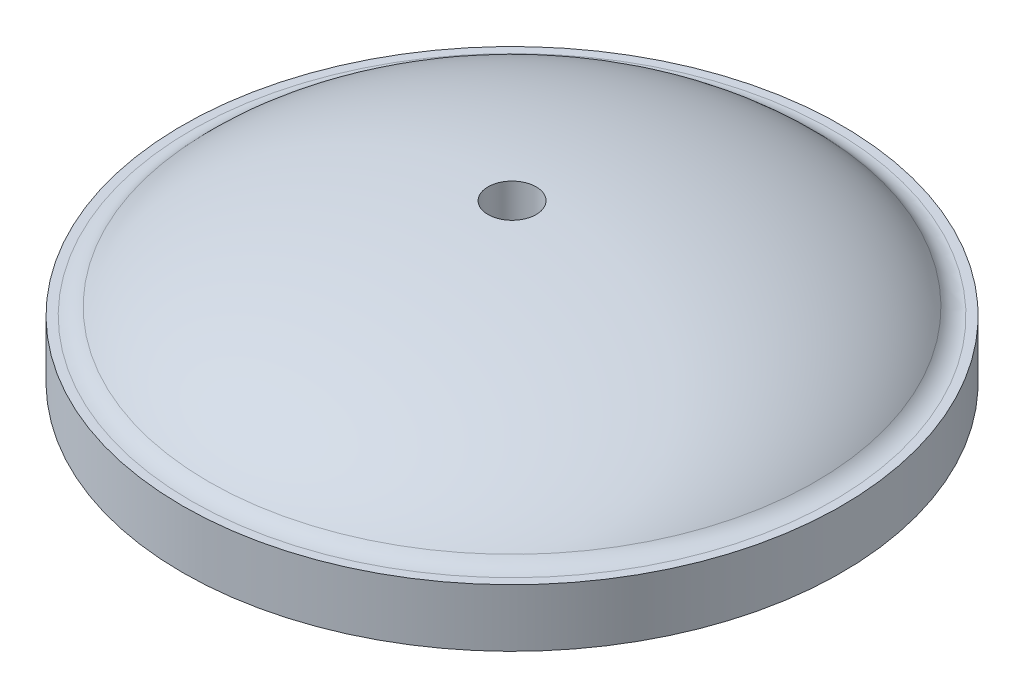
SolidWorks part; units mm, degrees
ref_plane "Plane1" through (0, 0, 0) normal (0, 0, 1) x (1, 0, 0)
ref_plane "Plane2" through (0, 0, 0) normal (0, 1, 0) x (1, 0, 0)
ref_plane "Plane3" through (0, 0, 0) normal (1, 0, 0) x (0, 0, -1)
sketch "Sketch2" plane through (0, 0, 0) normal (0, 0, 1) x (1, 0, 0)
  line L0 (-92.202, 0) -> (106.172, 0) construction
  line L1 (0, 86.36) -> (0, -75.946) construction
  line L2 (13.335, 22.4242) -> (13.335, 5.9944)
  line L3 (58.8, 22.4242) -> (13.335, 22.4242)
  line L4 (8.2296, 6.5024) -> (12.7, 6.5024) construction
  line L5 (71.5, 9.7242) -> (71.5, 5.9944)
  line L6 (71.5, 6.5024) -> (78.74, 6.5024) construction
  line L8 (87, -1.6256) -> (82.55, -1.6256)
  line L15 (2.65, 40.9956) -> (12.7, 40.9956) construction
  line L17 (13.335, 5.9944) -> (5.842, 5.9944)
  line L18 (5.842, 5.9944) -> (5.842, 39.9097)
  line L19 (82.55, 6.246) -> (82.55, -20.574) construction
  line L21 (71.5, 5.9944) -> (82.55, 5.9944)
  line L23 (84.724, 13.6144) -> (87, 13.6144)
  line L24 (87, 13.6144) -> (87, -1.6256)
  line L26 (82.55, -1.6256) -> (82.55, 5.9944)
  line L27 (87, 13.6144) -> (87, 13.731) construction
  arc A0 (58.8, 22.4242) -> (71.5, 9.7242) centre (58.8, 9.7242) cw
  arc A4 (80.0622, 15.6528) -> (84.724, 13.6144) centre (84.724, 19.9644) ccw
  ellipse E0 centre (0, 0) end of major axis (87, 0) minor radius 40 (80.0622, 15.6528) -> (5.842, 39.9097) ccw
  point P16 (0, 9.398)
  dimension "D11" = 16.4298
  dimension "D26" = 6.35
  dimension "D31" = 9.398
  dimension "D6" = 12.7
  dimension "D12" = 12.7
  dimension "D1" = 40
  dimension "D2" = 174
  dimension "D4" = 45.465
  dimension "D5" = 6.5024
  dimension "D7" = 143
  dimension "D13" = 80
  dimension "D16" = 40.9956
  dimension "D17" = 5.3
  dimension "D21" = 82.55
  dimension "D24" = 0.508
  dimension "D25" = 7.62
  dimension "D27" = 34.4932
  dimension "D28" = 26.67
  dimension "D36" = 165.1
  dimension "D37" = 8.128
  dimension "D39" = 7.112
revolve "Base-Revolve" add sketch "Sketch2" angle 360 about L1
ref_plane "Plane7" through (0, 7.5184, 0) normal (0, -1, 0) x (1, 0, 0)
sketch "Sketch3" plane through (0, 5.9944, 0) normal (0, -1, 0) x (1, 0, 0)
  line L4 (-5.08, 71.3193) -> (-5.08, 12.3295)
  line L5 (5.08, 71.3193) -> (5.08, 12.3295)
  arc A1 (-5.08, 71.3193) -> (5.08, 71.3193) centre (0, 0) cw
  arc A2 (-5.08, 12.3295) -> (5.08, 12.3295) centre (0, 0) cw
  dimension "D2" = 10.16
extrude "Ribs Extrude" add sketch "Sketch3" against normal up to surface (16.4298 mm away)
pattern_circular "CirPattern1" [suppressed] count 6 over 360 about axis through (0, 86.36, 0) along (0, -1, 0)
pattern_circular "CirPattern2" count 5 over 360 about axis through (0, 0, 0) along (0, 1, 0) of "Ribs Extrude"
sketch3d "3DSketch1"
  circle A0 centre (0, 39.9097, 0) radius 5.842 construction
  point P0 (-5.5622, 39.9097, 1.7863)
  point P3 (0, 45.7517, 0)
  point P4 (5.3646, 39.9097, 2.3131)
  point P5 (1.1102, 39.9097, -5.7355)
ref_plane "Plane8" through (0, 39.9097, 0) normal (0, -1, 0) x (1, 0, 0)
sketch "Sketch4" plane through (0, 5.9944, 0) normal (0, -1, 0) x (1, 0, 0)
  circle A0 centre (0, 0) radius 6.35 construction
  circle A1 centre (0, 0) radius 6.35
extrude "Cut-Extrude1" cut sketch "Sketch4" against normal up to next
